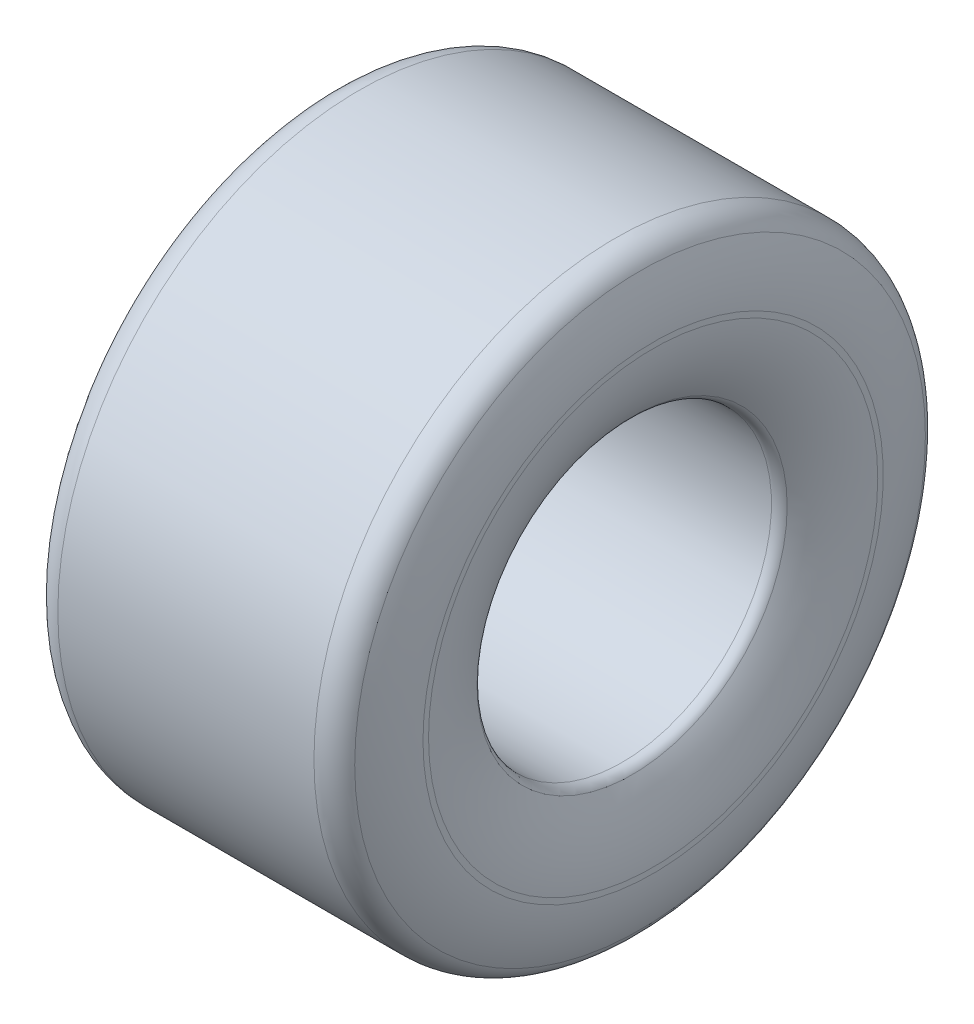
SolidWorks part; units mm, degrees
ref_plane "Front Plane" through (0, 0, 0) normal (0, 0, 1) x (1, 0, 0)
ref_plane "Top Plane" through (0, 0, 0) normal (0, 1, 0) x (1, 0, 0)
ref_plane "Right Plane" through (0, 0, 0) normal (1, 0, 0) x (0, 0, -1)
sketch "Sketch1" plane through (0, 0, 0) normal (0, 0, 1) x (1, 0, 0)
  line L0 (0, 0) -> (153.1434, 0) construction
  line L1 (0, 0) -> (0, 89.2481) construction
  line L2 (61.9125, 68.58) -> (-61.9125, 68.58)
  line L3 (-76.2, 103.0236) -> (-76.2, 105.5636)
  line L4 (-58.7375, 138.1125) -> (58.7375, 138.1125)
  line L5 (76.2, 103.0236) -> (76.2, 105.5636)
  line L6 (-76.2, 104.2936) -> (-14.4283, 104.2936) construction
  arc A0 (-61.9125, 68.58) -> (-66.559, 71.1311) centre (-61.9125, 74.0869) cw
  arc A1 (-70.2019, 130.8767) -> (-58.7375, 138.1125) centre (-58.7375, 125.4125) cw
  arc A2 (58.7375, 138.1125) -> (70.2019, 130.8767) centre (58.7375, 125.4125) cw
  arc A3 (66.559, 71.1311) -> (61.9125, 68.58) centre (61.9125, 74.0869) cw
  arc A4 (-70.2019, 130.8767) -> (-76.2, 105.5636) centre (-14.4283, 104.2936) ccw
  arc A5 (66.559, 71.1311) -> (76.2, 103.0236) centre (14.4283, 104.2936) ccw
  arc A6 (-76.2, 103.0236) -> (-66.559, 71.1311) centre (-14.4283, 104.2936) ccw
  arc A9 (76.2, 105.5636) -> (70.2019, 130.8767) centre (14.4283, 104.2936) ccw
  dimension "D3" = 5.5069
  dimension "D4" = 12.7
  dimension "D5" = 152.4
  dimension "D1" = 137.16
  dimension "D2" = 276.225
  dimension "D6" = 117.475
  dimension "D8" = 123.825
  dimension "D10" = 2.54
revolve "Revolve1" add sketch "Sketch1" angle 360 about L0
